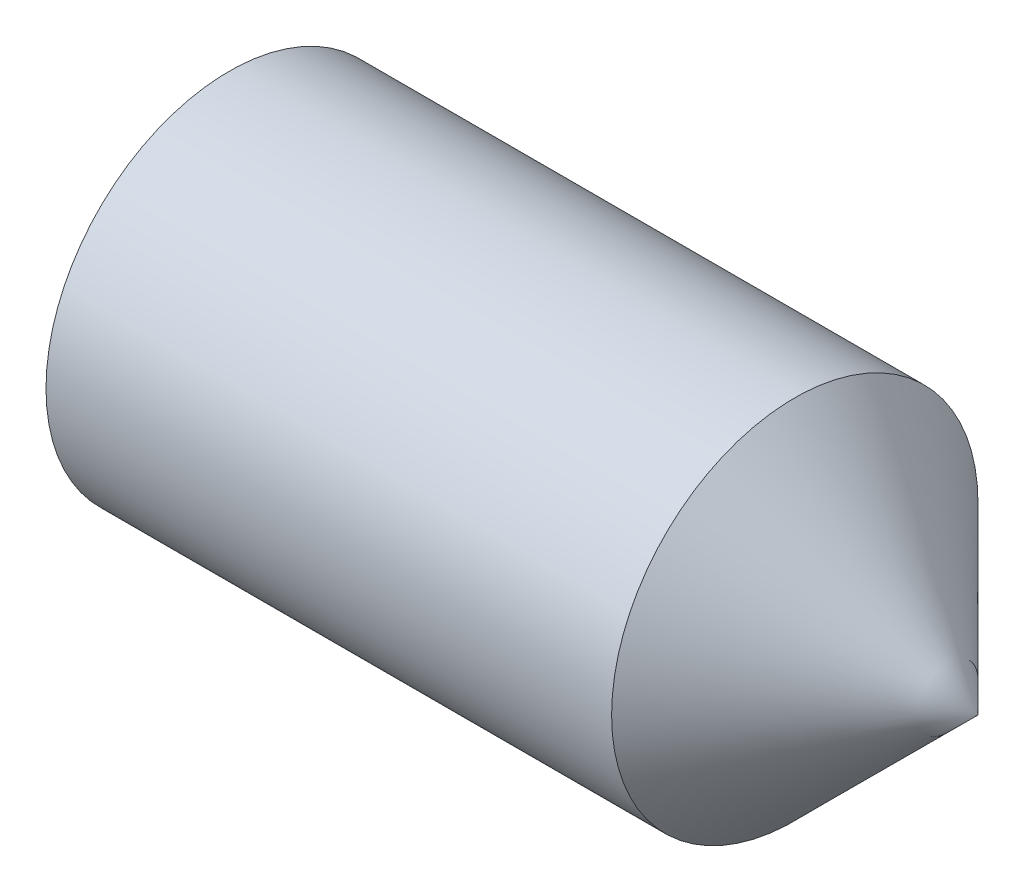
SolidWorks part; units mm, degrees
ref_plane "Plane1" through (0, 0, 0) normal (0, 0, 1) x (1, 0, 0)
ref_plane "Plane2" through (0, 0, 0) normal (0, 1, 0) x (1, 0, 0)
ref_plane "Plane3" through (0, 0, 0) normal (1, 0, 0) x (0, 0, -1)
sketch "BodySke" plane through (0, 0, 0) normal (0, 0, 1) x (1, 0, 0)
  line L0 (0, 0) -> (0, 10.352)
  line L1 (0, 10.352) -> (0.9515, 12)
  line L2 (0.9515, 12) -> (38, 12)
  line L3 (38, 12) -> (50, 0)
  line L4 (50, 0) -> (0, 0)
  line L5 (-12.7, 0) -> (88.9, 0) construction
  line L6 (38, -12) -> (50, 0) construction
  line L7 (1.5, 15.875) -> (1.5, -3.175) construction
  line L8 (0, -10.352) -> (0.9515, -12) construction
  dimension "Cone_ang" = 90
  dimension "Length" = 50
  dimension "Diameter" = 24
  dimension "Drive_ch_ang" = 60
  dimension "Minor_dia" = 20.704
  dimension "Advance" = 3
revolve "BaseBody" add sketch "BodySke" angle 360 about L5
sketch "Sketch2" plane through (0, 0, 0) normal (-1, 0, 0) x (0, 0, 1)
  line L0 (3.4641, 6) -> (-3.4641, 6)
  line L1 (-3.4641, 6) -> (-6.9282, 0)
  line L2 (3.4641, 6) -> (6.9282, 0)
  line L3 (3.4641, -6) -> (6.9282, 0)
  line L4 (3.4641, -6) -> (-3.4641, -6)
  line L5 (-3.4641, -6) -> (-6.9282, 0)
  dimension "Hex_size" = 12
  dimension "D2" = 6
  dimension "D3" = 6
extrude "Hex" cut sketch "Sketch2" against normal blind 15
sketch "ThdSchSke" plane through (0, 0, 0) normal (0, 0, 1) x (1, 0, 0)
  line L0 (0.9515, -10.352) -> (-0.2025, -12)
  line L1 (0.9515, -10.352) -> (2.1054, -12)
  line L2 (2.1054, -12) -> (2.1054, -15)
  line L3 (-3.175, 0) -> (5.1513, 0) construction
  line L4 (0.9515, 12) -> (0.9515, -12) construction
  line L5 (2.1054, -15) -> (-0.2025, -15)
  line L6 (-0.2025, -15) -> (-0.2025, -12)
  dimension "Thread_minor" = 20.704
  dimension "Diameter" = 24
  dimension "SideAngle" = 55
  dimension "VeeAngle" = 70
  dimension "Overcut" = 30
revolve "ThreadSchematic" [suppressed] cut sketch "ThdSchSke" angle 360 about L3
pattern_linear "ThdSchPat" [suppressed]
equation "\"D2@Sketch2\" = \"Hex_size@Sketch2\" / 2"
equation "\"D3@Sketch2\" = \"Hex_size@Sketch2\" / 2"
equation "\"Thread_minor@ThreadCosmetic\" = \"Minor_dia@BodySke\""
equation "\"Thread_minor@ThdSchSke\" = \"Thread_minor@ThreadCosmetic\""
equation "\"Diameter@ThdSchSke\" = \"Diameter@BodySke\""
equation "\"Overcut@ThdSchSke\" = \"Diameter@BodySke\" * 1.25"
equation "\"Num_threads@ThdSchPat\" = int( (\"Length@BodySke\" - ( ( ( \"Diameter@BodySke\" - \"Minor_dia@BodySke\" ) * 0.5 ) / tan( \"Drive_ch_ang@BodySke\" * 0.017453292 ) ) - ( ( \"Diameter@BodySke\" * 0.5 ) / tan( \"Con"
equation "\"Advance@ThdSchPat\" = (\"Length@BodySke\" - ( ( ( \"Diameter@BodySke\" - \"Minor_dia@BodySke\" ) * 0.5 ) / tan( \"Drive_ch_ang@BodySke\" * 0.017453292 ) ) - ( ( \"Diameter@BodySke\" * 0.5 ) / tan( \"Cone_ang@Bod"
equation "' \"Num_threads@ThdSchPat\" = \"Num_threads@ThdSchPat\" - sgn( \"Num_threads@ThdSchPat\" - 1) '---chamfered tips only---"
